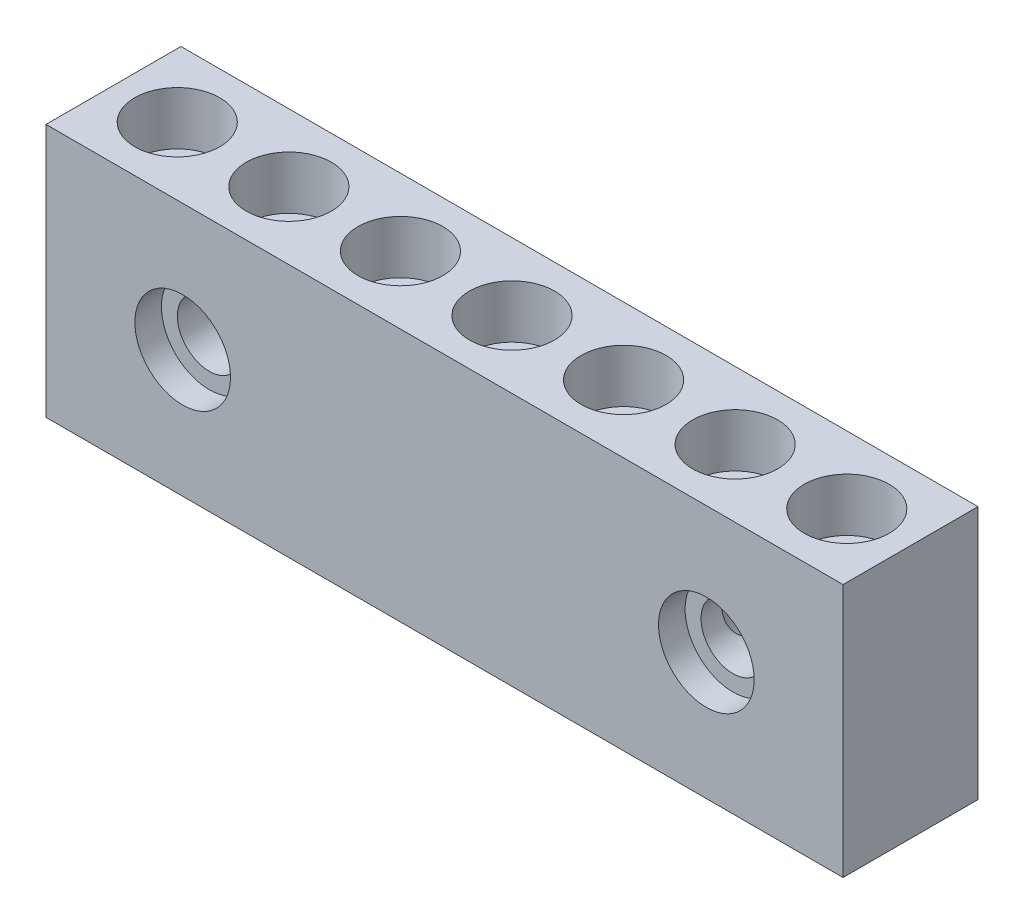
SolidWorks part; units mm, degrees
ref_plane "Front Plane" through (0, 0, 0) normal (0, 0, 1) x (1, 0, 0)
ref_plane "Top Plane" through (0, 0, 0) normal (0, 1, 0) x (1, 0, 0)
ref_plane "Right Plane" through (0, 0, 0) normal (1, 0, 0) x (0, 0, -1)
sketch "Sketch1" plane through (0, 0, 0) normal (0, 0, 1) x (1, 0, 0)
  line L1 (75, -23.875) -> (-75, -23.875)
  line L2 (75, -23.875) -> (75, 23.875)
  line L3 (75, 23.875) -> (-75, 23.875)
  line L4 (-75, -23.875) -> (-75, 23.875)
  line L5 (75, -23.875) -> (-75, 23.875) construction
  line L6 (75, 23.875) -> (-75, -23.875) construction
  point P0 (0, 0)
  dimension "D1" = 150
  dimension "D2" = 47.75
extrude "Boss-Extrude1" add sketch "Sketch1" along normal mid plane 25.4
sketch "Sketch2" plane through (0, 0, 0) normal (0, 0, 1) x (1, 0, 0)
  line L0 (0, 32.0168) -> (0, -37.0588) construction
sketch "Sketch3" plane through (0, 0, 12.7) normal (0, 0, 1) x (1, 0, 0)
  line L0 (-75, 23.875) -> (-75, -23.875) construction
  line L1 (-75, -23.875) -> (75, -23.875) construction
  circle A0 centre (-31.75, -6.405) radius 7.5
  circle A1 centre (31.75, -6.405) radius 7.5
  point P9 (-31.75, -6.405)
  point P10 (31.75, -6.405)
  dimension "D4" = 15
  dimension "D1" = 63.5
  dimension "D2" = 43.25
  dimension "D3" = 17.47
extrude "Cut-Extrude1" [suppressed] cut sketch "Sketch3" against normal up to surface (25.4 mm away)
sketch "Sketch4" plane through (0, 0, 12.7) normal (0, 0, 1) x (1, 0, 0)
  line L0 (-75, 23.875) -> (-75, -23.875) construction
  line L1 (-75, -23.875) -> (75, -23.875) construction
  circle A0 centre (-49.275, -0.005) radius 9
  circle A1 centre (49.275, -0.005) radius 9
  point P9 (49.275, -0.005)
  point P10 (-49.275, -0.005)
  dimension "D1" = 18
  dimension "D2" = 98.55
  dimension "D3" = 25.725
  dimension "D4" = 23.87
extrude "Cut-Extrude2" cut sketch "Sketch4" against normal blind 5
sketch "Sketch5" plane through (0, 0, 7.7) normal (0, 0, 1) x (1, 0, 0)
  circle A0 centre (-49.275, -0.005) radius 6
  circle A1 centre (49.275, -0.005) radius 6
  dimension "D1" = 12
extrude "Cut-Extrude3" cut sketch "Sketch5" against normal up to surface (20.4 mm away)
sketch "Sketch6" plane through (0, 23.875, 0) normal (0, 1, 0) x (1, 0, 0)
  line L0 (-75, -12.7) -> (-75, 12.7) construction
  circle A0 centre (-63, 0) radius 8
  point P2 (0, 0)
  point P6 (-63, 0)
  dimension "D1" = 16
  dimension "D2" = 12
extrude "Cut-Extrude4" cut sketch "Sketch6" against normal blind 10
sketch "Sketch7" plane through (0, 13.875, 0) normal (0, 1, 0) x (1, 0, 0)
  circle A0 centre (-63, 0) radius 4
  dimension "D1" = 8
extrude "Cut-Extrude5" cut sketch "Sketch7" against normal up to surface (37.75 mm away)
pattern_linear "LPattern1" count 7 spacing 21 along (1, 0, 0) of "Cut-Extrude4", "Cut-Extrude5"
